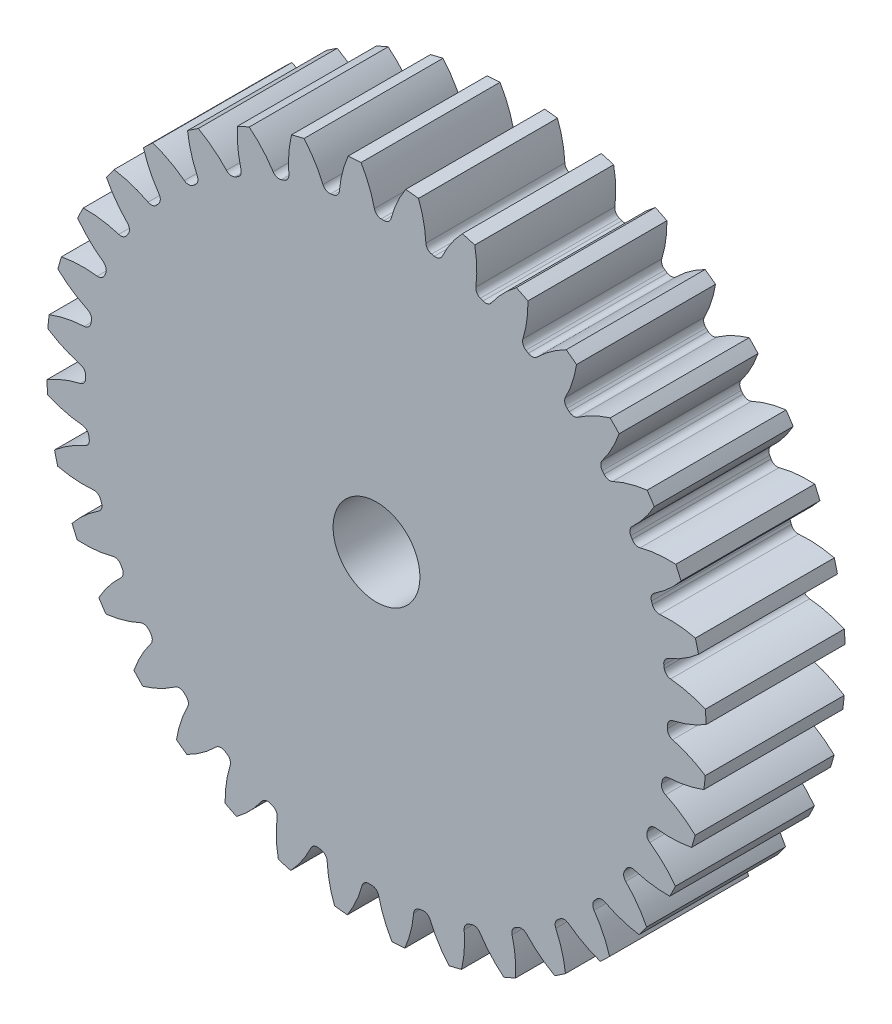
SolidWorks part; units mm, degrees
ref_plane "Front" through (0, 0, 0) normal (0, 0, 1) x (1, 0, 0)
ref_plane "Top" through (0, 0, 0) normal (0, 1, 0) x (1, 0, 0)
ref_plane "Right" through (0, 0, 0) normal (1, 0, 0) x (0, 0, -1)
sketch "Sketch3" plane through (0, 0, 0) normal (0, 0, 1) x (1, 0, 0)
  circle A0 centre (0, 0) radius 241.3
  dimension "od" = 482.6
extrude "gearBody" add sketch "Sketch3" along normal blind 101.6
sketch "Sketch2" plane through (0, 0, 0) normal (0, 0, 1) x (1, 0, 0)
  line L0 (0, 0) -> (198.462, 82.2057) construction
  line L1 (240.6137, -21.506) -> (0, 0) construction
  line L2 (0, 0) -> (36.3143, 0) construction
  line L3 (228.5412, 5.1831) -> (228.1279, -14.6841) construction
  line L5 (228.3346, -4.7505) -> (0, 0) construction
  line L7 (0, 0) -> (214.8137, 0) construction
  arc A0 (214.8107, 1.1504) -> (214.5769, -10.0838) centre (0, 0) ccw construction
  arc A1 (241.0343, 11.3196) -> (240.355, -21.3349) centre (0, 0) ccw construction
  arc A2 (228.5412, 5.1831) -> (228.1279, -14.6841) centre (0, 0) ccw construction
  arc A3 (212.6552, -5.4508) -> (212.6978, -3.3986) centre (0, 0) ccw
  arc A4 (240.6137, -21.506) -> (216.4721, -10.5727) centre (194.8712, -90.3889) ccw
  arc A5 (240.6137, -21.506) -> (241.3, 11.4798) centre (0, 0) ccw
  arc A6 (241.3, 11.4798) -> (216.7245, 1.56) centre (198.462, 82.2057) cw
  arc A7 (212.6978, -3.3986) -> (216.7245, 1.56) centre (217.8661, -3.4812) cw
  arc A8 (216.4721, -10.5727) -> (212.6552, -5.4508) centre (217.8224, -5.5833) cw
  point P6 (241.3, 11.4798)
  point P22 (240.6137, -21.506)
  dimension "baseDia" = 429.6275
  dimension "od" = 482.6
  dimension "pd" = 457.2
  dimension "rd" = 425.45
  dimension "rFillet" = 5.1689
  dimension "pointX" = 241.3
  dimension "pointY" = 11.4798
  dimension "CTT" = 19.8672
  dimension "flankCenterAngle" = 22.5
extrude "toothCut" cut sketch "Sketch2" along normal through all
pattern_circular "CirPattern1" count 36 over 360 about axis through (0, 0, 0) along (0, 0, 1) of "toothCut"
sketch "hub1Dia" plane through (0, 0, 0) normal (0, 0, -1) x (-1, 0, 0)
  circle A0 centre (0, 0) radius 12.7
  dimension "hub1Dia" = 25.4
sketch "hub2Dia" plane through (0, 0, 101.6) normal (0, 0, 1) x (1, 0, 0)
  circle A0 centre (0, 0) radius 12.7
  dimension "hub2dia" = 25.4
sketch "boreDia" plane through (0, 0, 0) normal (0, 0, 1) x (1, 0, 0)
  circle A0 centre (0, 0) radius 31.75
  dimension "boreDia" = 63.5
extrude "bore" cut sketch "boreDia" against normal mid plane 25400
